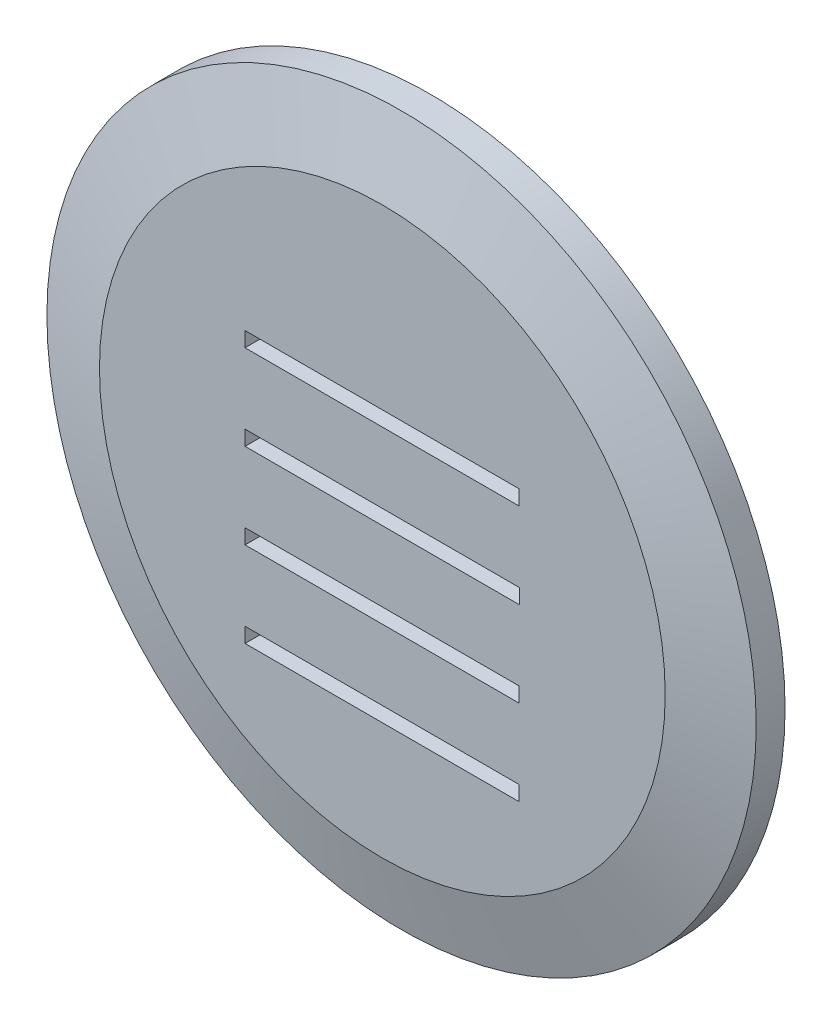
SolidWorks part; units mm, degrees
ref_plane "Front Plane" through (0, 0, 0) normal (0, 0, 1) x (1, 0, 0)
ref_plane "Top Plane" through (0, 0, 0) normal (0, 1, 0) x (1, 0, 0)
ref_plane "Right Plane" through (0, 0, 0) normal (1, 0, 0) x (0, 0, -1)
sketch "Sketch1" plane through (0, 0, 0) normal (0, 1, 0) x (1, 0, 0)
  line L0 (23.0505, 2.54) -> (0, 2.54)
  line L1 (0, 2.54) -> (0, -2.54)
  line L2 (0, -2.54) -> (29.8815, -2.54)
  line L3 (29.8815, -2.54) -> (37.465, -0.508)
  line L4 (37.465, -0.508) -> (37.465, 2.54)
  line L5 (37.465, 2.54) -> (26.2255, 2.54)
  line L6 (26.2255, 2.54) -> (26.2255, -0.127)
  line L7 (26.2255, -0.127) -> (23.0505, -0.127)
  line L8 (23.0505, -0.127) -> (23.0505, 2.54)
  line L9 (0, 2.54) -> (0, -2.54) construction
revolve "Revolve1" add sketch "Sketch1" angle 360 about L9
sketch "Sketch2" plane through (0, 0, 2.54) normal (0, 0, 1) x (1, 0, 0)
  line L1 (-14.5034, 2.1082) -> (14.5034, 2.1082)
  line L2 (-14.5034, 2.1082) -> (-14.5034, 0.5334)
  line L3 (-14.5034, 0.5334) -> (14.5034, 0.5334)
  line L4 (14.5034, 2.1082) -> (14.5034, 0.5334)
  line L5 (-14.5034, 11.1252) -> (14.4526, 11.1252)
  line L6 (-14.5034, 11.1252) -> (-14.5034, 9.5504)
  line L7 (-14.5034, 9.5504) -> (14.4526, 9.5504)
  line L8 (14.4526, 11.1252) -> (14.4526, 9.5504)
  line L9 (-14.5034, -6.9088) -> (14.4526, -6.9088)
  line L10 (-14.5034, -6.9088) -> (-14.5034, -8.4836)
  line L11 (-14.5034, -8.4836) -> (14.4526, -8.4836)
  line L12 (14.4526, -6.9088) -> (14.4526, -8.4836)
  line L13 (-14.5034, -15.9258) -> (14.4526, -15.9258)
  line L14 (-14.5034, -15.9258) -> (-14.5034, -17.5006)
  line L15 (-14.5034, -17.5006) -> (14.4526, -17.5006)
  line L16 (14.4526, -15.9258) -> (14.4526, -17.5006)
extrude "Cut-Extrude1" cut sketch "Sketch2" against normal through all
